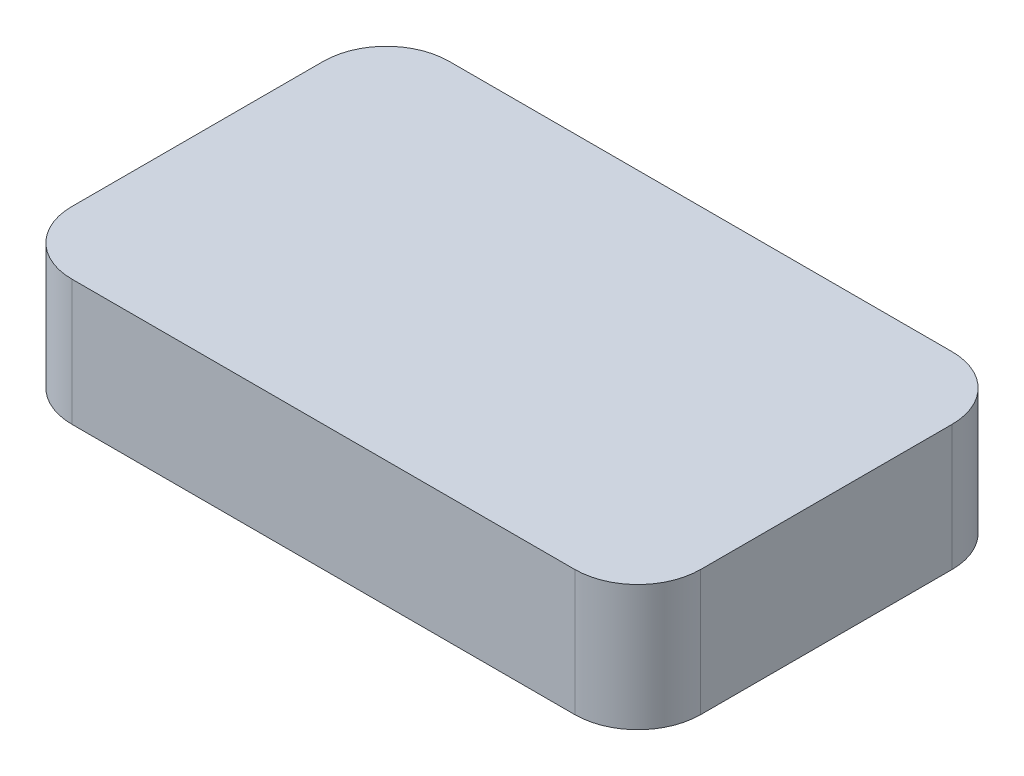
SolidWorks part; units mm, degrees
ref_plane "正面" through (0, 0, 0) normal (0, 0, 1) x (1, 0, 0)
ref_plane "平面" through (0, 0, 0) normal (0, 1, 0) x (1, 0, 0)
ref_plane "右側面" through (0, 0, 0) normal (1, 0, 0) x (0, 0, -1)
sketch "ｽｹｯﾁ1" plane through (0, 0, 0) normal (0, 1, 0) x (1, 0, 0)
  line L1 (-25, -15) -> (25, -15)
  line L2 (-25, -15) -> (-25, 15)
  line L3 (-25, 15) -> (25, 15)
  line L4 (25, -15) -> (25, 15)
  line L5 (-25, -15) -> (25, 15) construction
  line L6 (-25, 15) -> (25, -15) construction
  point P0 (0, 0)
  dimension "D1" = 50
  dimension "D2" = 30
extrude "ﾎﾞｽ - 押し出し1" add sketch "ｽｹｯﾁ1" along normal blind 10
fillet "ﾌｨﾚｯﾄ2" radius 5 4 edges at (25, 5, -15) (25, 5, 15) (-25, 5, -15) (-25, 5, 15)
